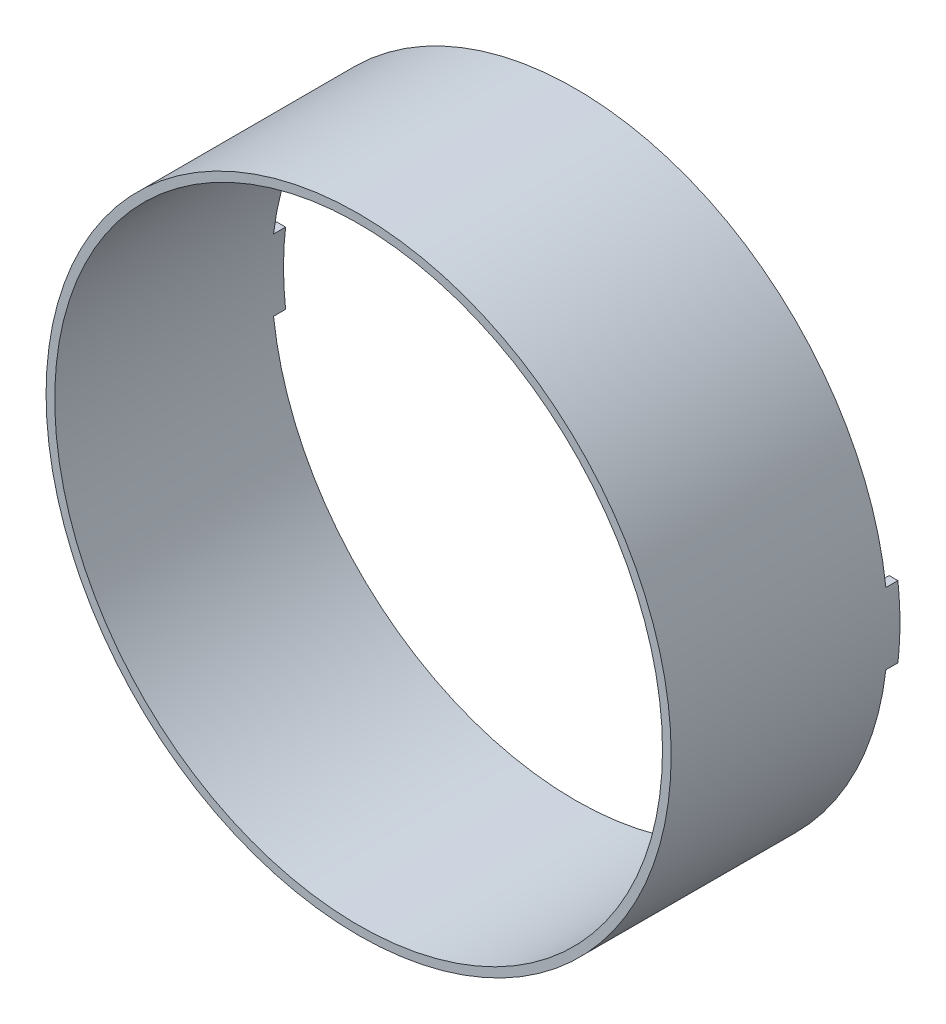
SolidWorks part; units mm, degrees
ref_plane "Front Plane" through (0, 0, 0) normal (0, 0, 1) x (1, 0, 0)
ref_plane "Top Plane" through (0, 0, 0) normal (0, 1, 0) x (1, 0, 0)
ref_plane "Right Plane" through (0, 0, 0) normal (1, 0, 0) x (0, 0, -1)
sketch "Sketch1" plane through (0, 0, 0) normal (0, 0, 1) x (1, 0, 0)
  line L0 (62.552, 31.6553) -> (64.5659, 31.6553) construction
  line L1 (64.5659, 46.6553) -> (62.552, 46.6553) construction
  line L2 (-62.552, 46.6553) -> (-64.5659, 46.6553)
  line L3 (-64.5659, 31.6553) -> (-62.552, 31.6553)
  line L4 (-62.552, 46.6553) -> (-64.5659, 46.6553) construction
  line L5 (-64.5659, 31.6553) -> (-62.552, 31.6553) construction
  line L6 (62.552, 31.6553) -> (64.5659, 31.6553) construction
  line L7 (64.5659, 46.6553) -> (62.552, 46.6553) construction
  line L8 (-64.4767, 31.7553) -> (-62.6646, 31.7553)
  line L9 (-62.6646, 46.5553) -> (-64.4767, 46.5553)
  line L10 (64.4767, 46.5553) -> (62.6646, 46.5553)
  line L11 (62.6646, 31.7553) -> (64.4767, 31.7553)
  arc A0 (64.5659, 31.6553) -> (64.5659, 46.6553) centre (0, 39.1553) ccw construction
  arc A1 (62.552, 31.6553) -> (62.552, 46.6553) centre (0, 39.1553) ccw construction
  arc A3 (-62.552, 46.6553) -> (-62.552, 31.6553) centre (0, 39.1553) ccw
  arc A4 (-64.5659, 46.6553) -> (-64.5659, 31.6553) centre (0, 39.1553) ccw
  arc A5 (-62.552, 46.6553) -> (-62.552, 31.6553) centre (0, 39.1553) ccw construction
  arc A6 (-64.5659, 46.6553) -> (-64.5659, 31.6553) centre (0, 39.1553) ccw construction
  arc A7 (64.5659, 31.6553) -> (64.5659, 46.6553) centre (0, 39.1553) ccw construction
  arc A8 (62.552, 31.6553) -> (62.552, 46.6553) centre (0, 39.1553) ccw construction
  arc A9 (-64.4767, 46.5553) -> (-64.4767, 31.7553) centre (0, 39.1553) ccw
  arc A10 (-62.6646, 46.5553) -> (-62.6646, 31.7553) centre (0, 39.1553) ccw
  arc A11 (64.4767, 31.7553) -> (64.4767, 46.5553) centre (0, 39.1553) ccw
  arc A12 (62.6646, 31.7553) -> (62.6646, 46.5553) centre (0, 39.1553) ccw
  dimension "D1" = 0
  dimension "D2" = 0.1
  dimension "D3" = 0.1
extrude "Boss-Extrude1" add sketch "Sketch1" against normal blind 2.5 contours A11 L10 A12 L11 | A9 L8 A10 L9
sketch "Sketch3" plane through (0, 0, 0) normal (0, 0, 1) x (1, 0, 0)
  circle A0 centre (0, 39.1553) radius 64.9
  circle A1 centre (0, 39.1553) radius 63.1
extrude "Boss-Extrude2" add sketch "Sketch3" along normal blind 45
